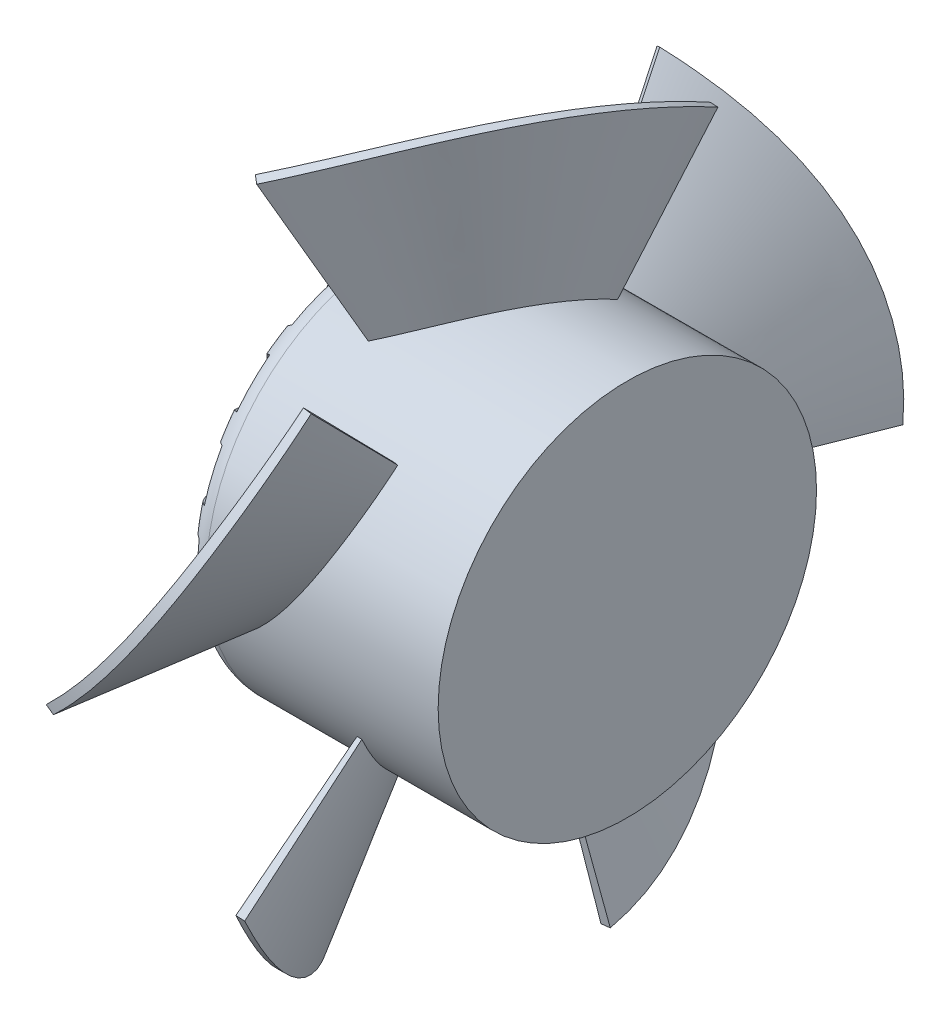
SolidWorks part; units mm, degrees
ref_plane "Front" through (0, 0, 0) normal (0, 0, 1) x (1, 0, 0)
ref_plane "Top" through (0, 0, 0) normal (0, 1, 0) x (1, 0, 0)
ref_plane "Right" through (0, 0, 0) normal (1, 0, 0) x (0, 0, -1)
sketch "Support-Front" plane through (0, 0, 0) normal (0, 0, 1) x (1, 0, 0)
  line L0 (-32, 0) -> (-5, 0) construction
  line L1 (-32, -20) -> (-32, 20)
  line L2 (-32, 20) -> (-5, 20)
  line L3 (-32, -20) -> (-5, -20)
  line L4 (-5, 20) -> (-5, -20)
  line L5 (-18.5, 20) -> (-18.5, -20) construction
  line L6 (-5, 20) -> (0, 20) construction
  line L7 (-5, -20) -> (0, -20) construction
  line L8 (0, 20) -> (0, -20) construction
  line L11 (-18.5, 20) -> (-18.5, 37) construction
  line L12 (-18.5, -20) -> (-18.5, -37) construction
  point P12 (0, 0)
  point P14 (-18.5, 0)
  dimension "Width" = 32
  dimension "Diam-Body" = 40
  dimension "Diam-Fan" = 74
  dimension "Dist-Fan" = 5
sketch "Support-Right" plane through (0, 0, 0) normal (1, 0, 0) x (0, 0, -1)
  line L0 (0, 0) -> (-3.3333, 0) construction
  line L1 (-3.3333, 0) -> (-6.6667, 0) construction
  line L2 (0, 20) -> (-2.4557, 19.1062) construction
  line L3 (-6.6667, 0) -> (-10, 0) construction
  line L4 (-10, 0) -> (-13.3333, 0) construction
  line L6 (0, 20) -> (0, -20) construction
  line L7 (0, 20) -> (0, -20) construction
  line L8 (2.4557, 20) -> (2.4557, 19.1062)
  line L9 (-2.4557, 20) -> (-2.4557, 19.1062)
  line L10 (2.4557, 20) -> (-2.4557, 20)
  line L11 (0, 20) -> (0, 19.1062) construction
  line L12 (0, 19.1062) -> (0, 16.6505) construction
  line L13 (0, 0) -> (-2.4557, 20) construction
  circle A0 centre (0, 0) radius 37
  circle A1 centre (0, 0) radius 13.3333
  circle A2 centre (0, 0) radius 6.6667
  circle A3 centre (0, 0) radius 3.3333
  arc A4 (2.4557, 19.1062) -> (-2.4557, 19.1062) centre (0, 19.1062) cw
  dimension "D1" = 7
  dimension "Diam-Motor" = 26.6667
  dimension "D2" = 20
sketch "Support-Fan-Blade-Top" plane through (0, 0, 0) normal (0, 1, 0) x (-1, 0, 0)
  line L0 (18.5, 0) -> (30.5957, 16.0515) construction
  line L1 (12.6237, -19.2204) -> (30.5957, 16.0515) construction
  line L2 (21.6097, -1.5845) -> (18.5, 0) construction
  line L4 (32, 0) -> (30.5957, 16.0515) construction
  line L5 (32, 0) -> (5, 0) construction
  line L6 (29.9137, 16.7829) -> (30.5957, 16.0515)
  line L7 (11.6312, -19.0986) -> (12.6237, -19.2204)
  arc A0 (30.5957, 16.0515) -> (12.6237, -19.2204) centre (70.0641, -26.2732) ccw
  arc A1 (29.9137, 16.7829) -> (11.6312, -19.0986) centre (70.0641, -26.2732) ccw
  dimension "D2" = 1
  dimension "D1" = 10
  dimension "D3" = 85
  dimension "Angle-Fan-Blade" = 117
ref_plane "Plane-Angle-Fan-Blade" through (-14.687, 0, -7.4834) normal (-0.891, 0, -0.454) x (-0.454, 0, 0.891)
ref_plane "Plane-Top-Fan-Blade" through (0, 37, 0) normal (0, 1, 0) x (-1, 0, 0)
sketch "Sketch-Blade-Bottom" plane through (0, 0, 0) normal (0, 1, 0) x (1, 0, 0)
  point P0 (-18.5, 0)
sketch "Sketch-Blade-Top" plane through (0, 37, 0) normal (0, 1, 0) x (-1, 0, 0)
  line L2 (30.5957, 16.0515) -> (29.9137, 16.7829)
  line L3 (11.6312, -19.0986) -> (12.6237, -19.2204)
  line L4 (30.5957, 16.0515) -> (29.9137, 16.7829)
  line L5 (11.6312, -19.0986) -> (12.6237, -19.2204)
  arc A3 (29.9137, 16.7829) -> (11.6312, -19.0986) centre (70.0641, -26.2732) ccw
  arc A4 (30.5957, 16.0515) -> (12.6237, -19.2204) centre (70.0641, -26.2732) ccw
  arc A5 (29.9137, 16.7829) -> (11.6312, -19.0986) centre (70.0641, -26.2732) ccw
  arc A6 (30.5957, 16.0515) -> (12.6237, -19.2204) centre (70.0641, -26.2732) ccw
  dimension "D1" = 0
ref_plane "Plane-Right-Cut" through (-32, 0, 0) normal (1, 0, 0) x (0, 0, -1)
sketch "Sketch5" plane through (0, 0, 0) normal (0, 0, 1) x (1, 0, 0)
  line L0 (-5, 20) -> (-5, -20) construction
  line L1 (-32, -20) -> (-32, 20) construction
  line L4 (-5, 20) -> (-5, 0)
  line L5 (-32, 0) -> (-32, 20)
  line L6 (-32, 0) -> (-5, 0)
  line L7 (-32, 20) -> (-5, 20) construction
  line L8 (-32, 0) -> (-5, 0) construction
  line L9 (-32, 0) -> (-5, 0) construction
  line L10 (-32, 20) -> (-5, 20)
revolve "Body" add sketch "Sketch5" angle 360 about L9
loft "Loft-Fan-Blade" add profiles "Sketch-Blade-Top", "Sketch-Blade-Bottom"
pattern_circular "CirPattern1" count 5 over 360 about axis through (-32, 0, 0) along (1, 0, 0) of "Loft-Fan-Blade"
sketch "Sketch-Cut-Blade" plane through (0, 0, 0) normal (1, 0, 0) x (0, 0, -1)
  circle A0 centre (0, 0) radius 37 construction
  circle A1 centre (0, 0) radius 37
extrude "Cut-Fan-Blade" cut sketch "Sketch-Cut-Blade" against normal through all flip side to cut
sketch "Sketch6" plane through (-32, 0, 0) normal (1, 0, 0) x (0, 0, -1)
  circle A0 centre (0, 0) radius 13.3333 construction
  circle A1 centre (0, 0) radius 13.3333
extrude "Cut-Body" cut sketch "Sketch6" along normal blind 1.25
sketch "Sketch7" plane through (-32, 0, 0) normal (1, 0, 0) x (0, 0, -1)
  circle A0 centre (0, 0) radius 3.3333 construction
  circle A1 centre (0, 0) radius 6.6667 construction
  circle A2 centre (0, 0) radius 3.3333
  circle A3 centre (0, 0) radius 6.6667
fillet "Cosmetic-Fillet" radius 2.5 1 edges at (-32, 0, 20)
sketch "Sketch8" plane through (-32, 0, 0) normal (1, 0, 0) x (0, 0, -1)
  line L0 (2.4557, 20) -> (2.4557, 19.1062) construction
  line L1 (2.4557, 20) -> (-2.4557, 20) construction
  line L2 (-2.4557, 20) -> (-2.4557, 19.1062) construction
  line L3 (2.4557, 20) -> (2.4557, 19.1062)
  line L4 (2.4557, 20) -> (-2.4557, 20)
  line L5 (-2.4557, 20) -> (-2.4557, 19.1062)
  arc A0 (-2.4557, 19.1062) -> (2.4557, 19.1062) centre (0, 19.1062) ccw construction
  arc A1 (-2.4557, 19.1062) -> (2.4557, 19.1062) centre (0, 19.1062) ccw
extrude "Cut-Body-Cosmetic-Body" cut sketch "Sketch8" along normal up to surface (1.25 mm away)
pattern_circular "CirPattern-Cut-Body-Cosmetic-Body" count 16 over 360 about axis through (0, 0, 0) along (1, 0, 0) of "Cut-Body-Cosmetic-Body"
extrude "Extrude3" cut sketch "Sketch7" along normal blind 1.6667
equation "\"Angle-Blade@Plane-Angle-Fan-Blade\" = \"Angle-Fan-Blade@Support-Fan-Blade-Top\""
equation "\"Rad@Cosmetic-Fillet\" = \"Dist-Fan@Support-Front\" / 2"
equation "\"Diam-Motor@Support-Right\" = \"Diam-Body@Support-Front\" / 1.5"
equation "\"Depth@Cut-Body\" = \"Dist-Fan@Support-Front\" / 4"
equation "\"D1@Extrude3\" = \"Dist-Fan@Support-Front\" / 3"
